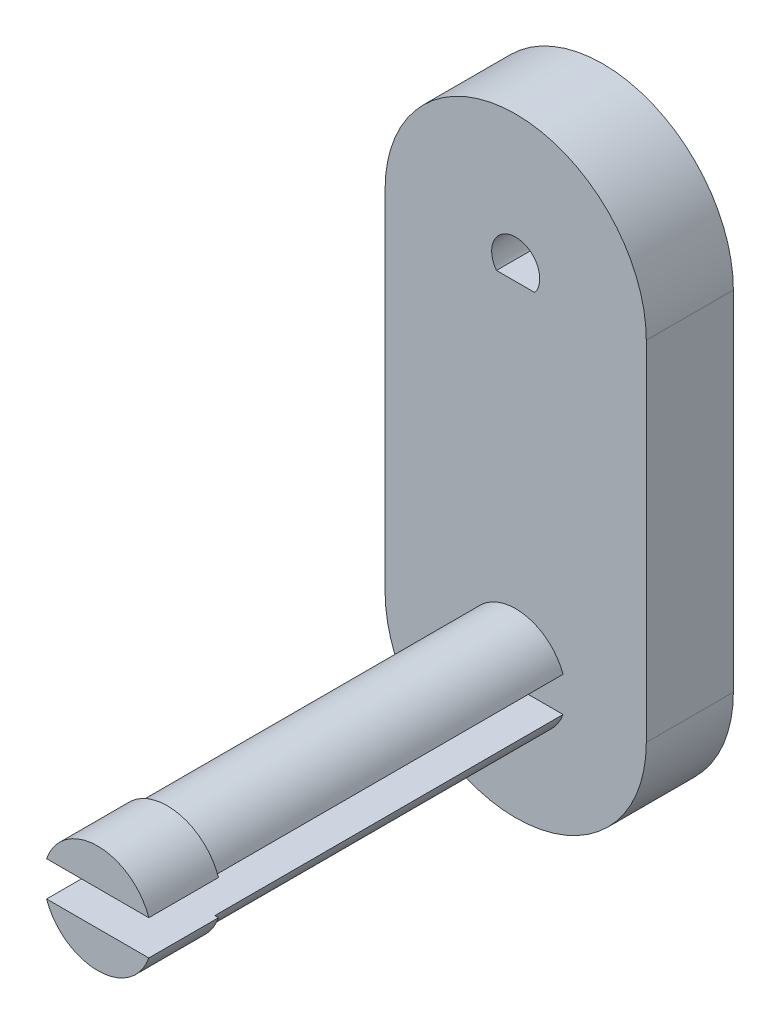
SolidWorks part; units mm, degrees
ref_plane "Plan de face" through (0, 0, 0) normal (0, 0, 1) x (1, 0, 0)
ref_plane "Plan de dessus" through (0, 0, 0) normal (0, 1, 0) x (1, 0, 0)
ref_plane "Plan de droite" through (0, 0, 0) normal (1, 0, 0) x (0, 0, -1)
sketch "Esquisse1" plane through (0, 0, 0) normal (0, 0, -1) x (-1, 0, 0)
  line L0 (0, 0) -> (0, -20) construction
  line L1 (7.5, 0) -> (7.5, -20)
  line L2 (-7.5, 0) -> (-7.5, -20)
  arc A0 (7.5, 0) -> (-7.5, 0) centre (0, 0) ccw
  arc A1 (-7.5, -20) -> (7.5, -20) centre (0, -20) ccw
  point P4 (0, -10)
  dimension "D1" = 15
extrude "Boss.-Extru.1" add sketch "Esquisse1" along normal blind 5 from offset 10
sketch "Esquisse2" plane through (0, 0, -10) normal (0, 0, 1) x (1, 0, 0)
  circle A0 centre (0, -20) radius 2.9
  dimension "D1" = 5.8
extrude "Boss.-Extru.2" add sketch "Esquisse2" along normal blind 20
sketch "Esquisse3" plane through (0, 0, 10) normal (0, 0, 1) x (1, 0, 0)
  circle A0 centre (0, -20) radius 3.1
  dimension "D1" = 6.2
extrude "Boss.-Extru.3" add sketch "Esquisse3" along normal blind 4
sketch "Esquisse4" plane through (0, 0, 14) normal (0, 0, 1) x (1, 0, 0)
  line L1 (-5, -19) -> (5, -19)
  line L2 (-5, -19) -> (-5, -21)
  line L3 (-5, -21) -> (5, -21)
  line L4 (5, -19) -> (5, -21)
  point P4 (0, -21)
  dimension "D1" = 1
  dimension "D2" = 1
  dimension "D3" = 10
  dimension "D4" = 5
extrude "Enlèv. mat.-Extru.1" cut sketch "Esquisse4" against normal blind 24
sketch "Esquisse5" plane through (0, 0, -10) normal (0, 0, 1) x (1, 0, 0)
  line L0 (0, -0.83) -> (-1.1025, -0.83)
  line L1 (-1.1025, -0.83) -> (1.1025, -0.83)
  circle A0 centre (0, 0) radius 0.83
  circle A1 centre (0, 0) radius 1.38
  arc A2 (-1.1025, -0.83) -> (1.1025, -0.83) centre (0, 0) cw
  dimension "D1" = 1.66
extrude "Enlèv. mat.-Extru.2" cut sketch "Esquisse5" against normal blind 24 contours A0 | L1 A1 L0 A0
